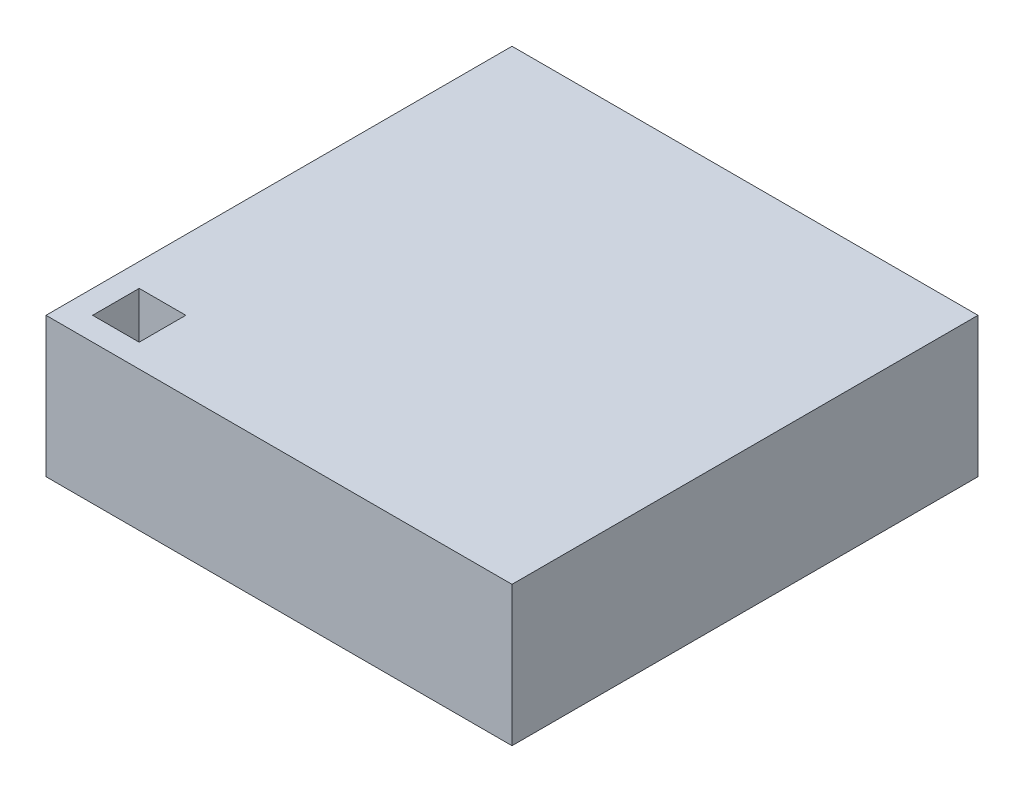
SolidWorks part; units mm, degrees
ref_plane "Front" through (0, 0, 0) normal (0, 0, 1) x (1, 0, 0)
ref_plane "Top" through (0, 0, 0) normal (0, 1, 0) x (1, 0, 0)
ref_plane "Right" through (0, 0, 0) normal (1, 0, 0) x (0, 0, -1)
sketch "Sketch1" plane through (0, 0, 0) normal (0, 1, 0) x (1, 0, 0)
  line L0 (50, -50) -> (-50, 50) construction
  line L1 (-50, 50) -> (50, 50)
  line L2 (-50, 50) -> (-50, -50)
  line L3 (-50, -50) -> (50, -50)
  line L4 (50, 50) -> (50, -50)
  dimension "D1" = 100
  dimension "D2" = 100
extrude "Extrude1" add sketch "Sketch1" along normal blind 30
sketch "Sketch2" plane through (0, 30, 0) normal (0, 1, 0) x (-1, 0, 0)
  line L0 (50, -50) -> (50, 50) construction
  line L1 (45, 45) -> (35, 45)
  line L2 (45, 45) -> (45, 35)
  line L3 (45, 35) -> (35, 35)
  line L4 (35, 45) -> (35, 35)
  line L5 (50, 50) -> (-50, 50) construction
  dimension "D1" = 5
  dimension "D2" = 5
  dimension "D3" = 10
extrude "Cut-Extrude1" cut sketch "Sketch2" against normal through all
